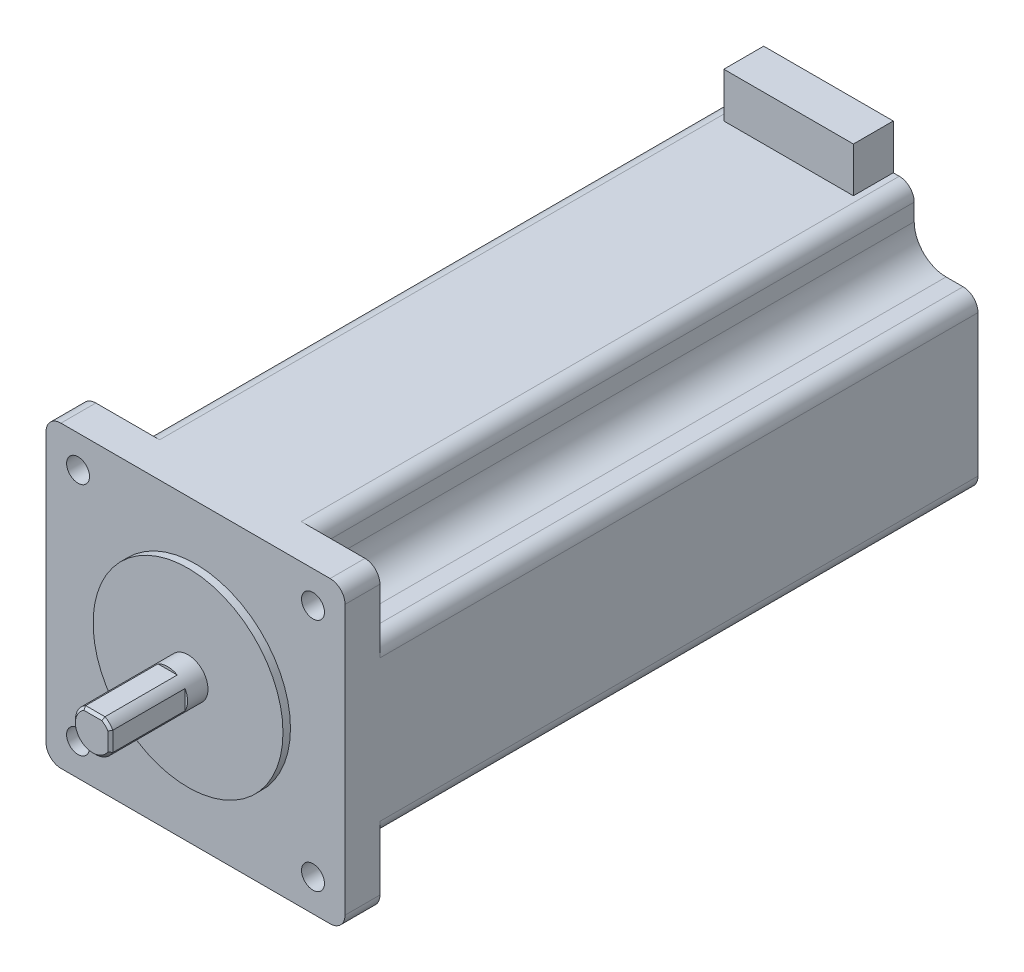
SolidWorks part; units mm, degrees
ref_plane "前视基准面" through (0, 0, 0) normal (0, 0, 1) x (1, 0, 0)
ref_plane "上视基准面" through (0, 0, 0) normal (0, 1, 0) x (1, 0, 0)
ref_plane "右视基准面" through (0, 0, 0) normal (1, 0, 0) x (0, 0, -1)
sketch "草图1" plane through (0, 0, 0) normal (0, 0, 1) x (1, 0, 0)
  circle A0 centre (0, 0) radius 19.05
extrude "凸台-拉伸1" add sketch "草图1" against normal blind 1.5
sketch "草图2" plane through (0, 0, 0) normal (0, 0, 1) x (1, 0, 0)
  circle A0 centre (0, 0) radius 4
extrude "凸台-拉伸2" add sketch "草图2" along normal blind 19.1
sketch "草图3" plane through (0, 0, 19.1) normal (0, 0, 1) x (1, 0, 0)
  line L0 (3.5, 0) -> (3.5, -4)
  line L1 (0, 3.5) -> (3, 3.5)
  line L2 (3, 3.5) -> (3, 6.1575)
  line L3 (3, 6.1575) -> (-4, 6.1575)
  line L4 (-4, 6.1575) -> (-4, 3.5)
  line L5 (-4, 3.5) -> (0, 3.5)
  line L7 (3.5, -4) -> (7.6659, -4)
  line L8 (7.6659, -4) -> (7.6659, 3.5)
  line L9 (7.6659, 3.5) -> (3.5, 3.5)
  line L10 (3.5, 3.5) -> (3.5, 0)
extrude "切除-拉伸1" cut sketch "草图3" against normal blind 15
chamfer "倒角1" distance 0.5 angle 45 4 edges at (0, 3.5, 19.1) (2.8284, 2.8284, 19.1) (-2.8284, -2.8284, 19.1) (3.5, 0, 19.1)
sketch "草图4" plane through (0, 0, -1.5) normal (0, 0, -1) x (-1, 0, 0)
  line L1 (0, 30) -> (27, 30)
  line L2 (30, 27) -> (30, -27)
  line L3 (27, -30) -> (-27, -30)
  line L4 (-30, -27) -> (-30, 27)
  line L5 (-27, 30) -> (0, 30)
  arc A0 (-27, -30) -> (-30, -27) centre (-27, -27) cw
  arc A1 (30, -27) -> (27, -30) centre (27, -27) cw
  arc A2 (27, 30) -> (30, 27) centre (27, 27) cw
  arc A3 (-30, 27) -> (-27, 30) centre (-27, 27) cw
  circle A4 centre (23.57, 23.57) radius 2.3
  circle A5 centre (23.57, -23.57) radius 2.3
  circle A6 centre (-23.57, -23.57) radius 2.3
  circle A7 centre (-23.57, 23.57) radius 2.3
  dimension "D1" = 3
extrude "凸台-拉伸3" add sketch "草图4" along normal blind 127
sketch "草图5" plane through (0, 0, -128.5) normal (0, 0, -1) x (-1, 0, 0)
  line L1 (27, 30) -> (-27, 30) construction
  line L2 (10.2835, 30) -> (14.2, 30)
  line L3 (17.2, 27) -> (17.2, 23.6)
  line L4 (23.6, 17.2) -> (27, 17.2)
  line L5 (-10.2835, 39.1307) -> (-10.2835, 30)
  line L6 (30, -27) -> (30, 27) construction
  line L7 (30, 14.2) -> (30, 9.8667)
  line L8 (30, 9.8667) -> (35.4123, 9.8667)
  line L9 (35.4123, 9.8667) -> (35.4123, 39.1307)
  line L10 (35.4123, 39.1307) -> (10.2835, 39.1307)
  line L11 (10.2835, 39.1307) -> (10.2835, 30)
  line L13 (-35.4123, 39.1307) -> (-10.2835, 39.1307)
  line L14 (-35.4123, 9.8667) -> (-35.4123, 39.1307)
  line L15 (-30, 9.8667) -> (-35.4123, 9.8667)
  line L16 (-30, 14.2) -> (-30, 9.8667)
  line L17 (-23.6, 17.2) -> (-27, 17.2)
  line L18 (-17.2, 27) -> (-17.2, 23.6)
  line L19 (-10.2835, 30) -> (-14.2, 30)
  line L20 (10.2835, -39.1307) -> (10.2835, -30)
  line L21 (35.4123, -39.1307) -> (10.2835, -39.1307)
  line L22 (35.4123, -9.8667) -> (35.4123, -39.1307)
  line L23 (30, -9.8667) -> (35.4123, -9.8667)
  line L24 (30, -14.2) -> (30, -9.8667)
  line L25 (23.6, -17.2) -> (27, -17.2)
  line L26 (17.2, -27) -> (17.2, -23.6)
  line L27 (10.2835, -30) -> (14.2, -30)
  line L28 (-10.2835, -30) -> (-14.2, -30)
  line L29 (-17.2, -27) -> (-17.2, -23.6)
  line L30 (-23.6, -17.2) -> (-27, -17.2)
  line L31 (-30, -14.2) -> (-30, -9.8667)
  line L32 (-30, -9.8667) -> (-35.4123, -9.8667)
  line L33 (-35.4123, -9.8667) -> (-35.4123, -39.1307)
  line L34 (-35.4123, -39.1307) -> (-10.2835, -39.1307)
  line L35 (-10.2835, -39.1307) -> (-10.2835, -30)
  arc A0 (17.2, 23.6) -> (23.6, 17.2) centre (23.6, 23.6) ccw
  arc A1 (27, 17.2) -> (30, 14.2) centre (27, 14.2) cw
  arc A2 (14.2, 30) -> (17.2, 27) centre (14.2, 27) cw
  arc A3 (-14.2, 30) -> (-17.2, 27) centre (-14.2, 27) ccw
  arc A4 (-27, 17.2) -> (-30, 14.2) centre (-27, 14.2) ccw
  arc A5 (-17.2, 23.6) -> (-23.6, 17.2) centre (-23.6, 23.6) cw
  arc A6 (14.2, -30) -> (17.2, -27) centre (14.2, -27) ccw
  arc A7 (27, -17.2) -> (30, -14.2) centre (27, -14.2) ccw
  arc A8 (17.2, -23.6) -> (23.6, -17.2) centre (23.6, -23.6) cw
  arc A9 (-17.2, -23.6) -> (-23.6, -17.2) centre (-23.6, -23.6) ccw
  arc A10 (-27, -17.2) -> (-30, -14.2) centre (-27, -14.2) cw
  arc A11 (-14.2, -30) -> (-17.2, -27) centre (-14.2, -27) cw
  point P20 (30, 17.2)
  point P23 (17.2, 30)
  point P38 (-17.2, 30)
  point P39 (-30, 17.2)
  point P54 (17.2, -30)
  point P55 (30, -17.2)
  point P70 (-30, -17.2)
  point P71 (-17.2, -30)
  dimension "D1" = 6.4
  dimension "D2" = 3
extrude "切除-拉伸2" cut sketch "草图5" against normal blind 120
sketch "草图6" plane through (0, 0, -128.5) normal (0, 0, -1) x (-1, 0, 0)
  line L0 (0, 30) -> (13, 30)
  line L1 (14.2, 30) -> (-14.2, 30) construction
  line L2 (13, 30) -> (13, 39)
  line L3 (13, 39) -> (-13, 39)
  line L4 (-13, 39) -> (-13, 30)
  line L5 (-13, 30) -> (0, 30)
extrude "凸台-拉伸4" add sketch "草图6" against normal blind 8 separate body
